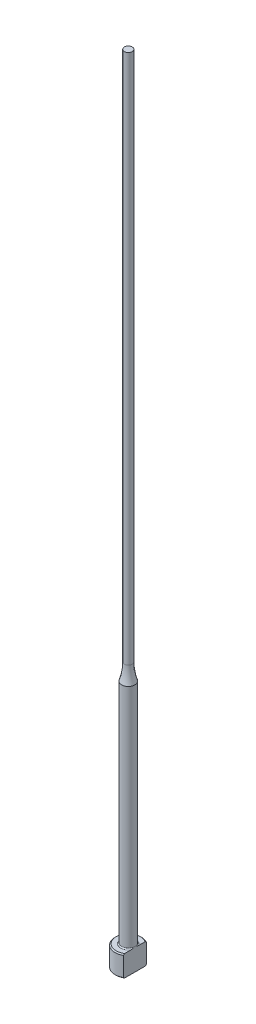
SolidWorks part; units mm, degrees
ref_plane "Front Plane" through (0, 0, 0) normal (0, 0, 1) x (1, 0, 0)
ref_plane "Top Plane" through (0, 0, 0) normal (0, 1, 0) x (1, 0, 0)
ref_plane "Right Plane" through (0, 0, 0) normal (1, 0, 0) x (0, 0, -1)
sketch "Sketch1" plane through (0, 0, 0) normal (0, 0, 1) x (1, 0, 0)
  line L0 (0, 259.9588) -> (0, -15.1925) construction
  line L1 (0, 0) -> (-2.5, 0)
  line L2 (-2.5, 0) -> (-2.5, 4)
  line L3 (-2.5, 4) -> (-1.25, 4)
  line L4 (-0.75, 50) -> (-0.75, 150)
  line L5 (-0.75, 150) -> (0, 150)
  line L6 (0, 150) -> (0, 0)
  line L7 (-1.25, 4) -> (-1.25, 46.8775)
  arc A0 (-1.25, 46.8775) -> (-0.75, 50) centre (-10.75, 50) ccw
  point P13 (-1.25, 0)
  dimension "D1" = 10
  dimension "L" = 150
  dimension "H" = 5
  dimension "T" = 4
  dimension "D" = 1.5
  dimension "B" = 2.5
  dimension "S" = 50
revolve "Revolve1" add sketch "Sketch1" angle 360 about L0
chamfer "Chamfer1" distance 0.2 angle 45 2 edges at (0, 4, 2.5) (0, 0, 2.5)
fillet "Fillet1" radius 0.2 1 edges at (0, 4, 1.25)
sketch "Sketch2" plane through (0, 0, 0) normal (0, 1, 0) x (1, 0, 0)
  line L0 (1.25, -2.1651) -> (1.25, 2.1651)
  circle A0 centre (0, 0) radius 2.5 construction
  arc A1 (1.25, -2.1651) -> (1.25, 2.1651) centre (0, 0) ccw
  circle A2 centre (0, 0) radius 1.25 construction
extrude "Keyed Head" cut sketch "Sketch2" along normal through all
